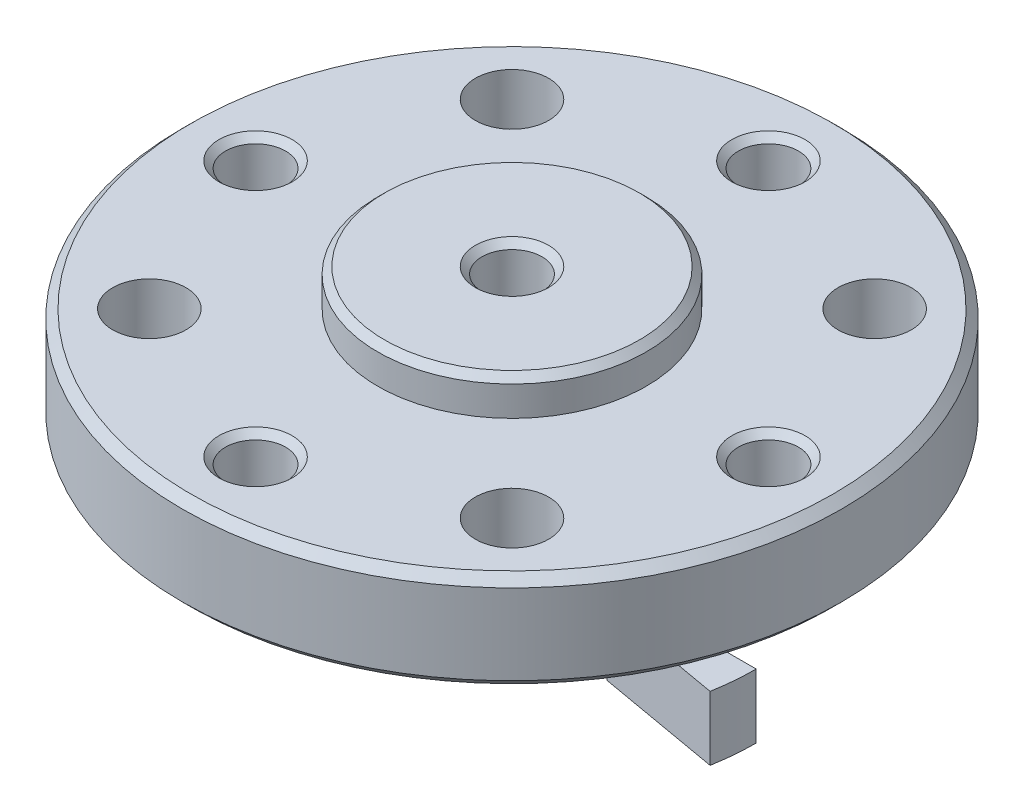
SolidWorks part; units mm, degrees
ref_plane "Ebene vorne" through (0, 0, 0) normal (0, 0, 1) x (1, 0, 0)
ref_plane "Ebene oben" through (0, 0, 0) normal (0, 1, 0) x (1, 0, 0)
ref_plane "Ebene rechts" through (0, 0, 0) normal (1, 0, 0) x (0, 0, -1)
imported_body "Importiert1"
other "2"
sketch "Skizze1" plane through (0, 18.2, 0) normal (0, 1, 0) x (1, 0, 0)
  line L0 (0, 42.05) -> (30, 42.05)
  dimension "D1" = 30
